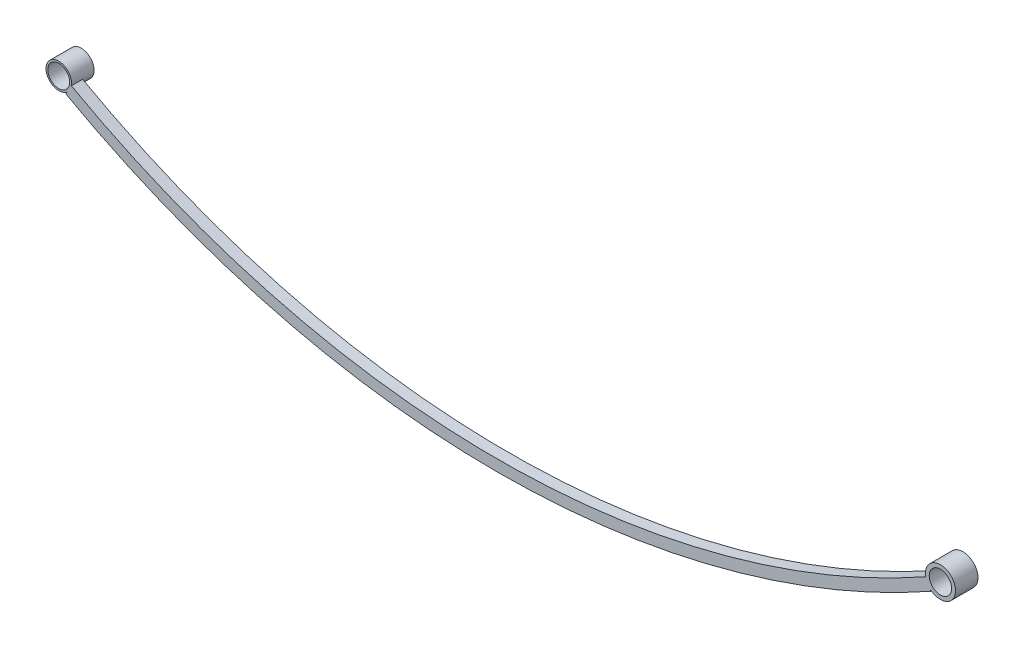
SolidWorks part; units mm, degrees
ref_plane "Plan de face" through (0, 0, 0) normal (0, 0, 1) x (1, 0, 0)
ref_plane "Plan de dessus" through (0, 0, 0) normal (0, 1, 0) x (1, 0, 0)
ref_plane "Plan de droite" through (0, 0, 0) normal (1, 0, 0) x (0, 0, -1)
sketch "Esquisse1" plane through (0, 0, 0) normal (0, 0, 1) x (1, 0, 0)
  line L0 (-504.0111, -292.485) -> (279.2564, -290.311) construction
  circle A0 centre (-504.0111, -292.485) radius 11.3485
  circle A1 centre (-504.0111, -292.485) radius 9.7458
  circle A2 centre (279.2564, -290.311) radius 9.9554
  circle A3 centre (279.2564, -290.311) radius 13.3832
  dimension "D1" = 783.2674
extrude "Extrusion1" add sketch "Esquisse1" along normal blind 20
sketch "Esquisse2" plane through (0, 0, 20) normal (0, 0, 1) x (1, 0, 0)
  line L0 (-497.7005, -303.2431) -> (-492.8433, -294.502)
  line L1 (266.1028, -292.7797) -> (270.9996, -301.4987)
  arc A0 (-492.8433, -294.502) -> (266.1028, -292.7797) centre (-114.9117, 385.6273) ccw
  circle A1 centre (-504.0111, -292.485) radius 11.3485 construction
  circle A2 centre (279.2564, -290.311) radius 13.3832 construction
  arc A3 (-497.7005, -303.2431) -> (270.9996, -301.4987) centre (-114.9117, 385.6273) ccw
  dimension "D1" = 10
extrude "Extrusion2" add sketch "Esquisse2" against normal blind 10
